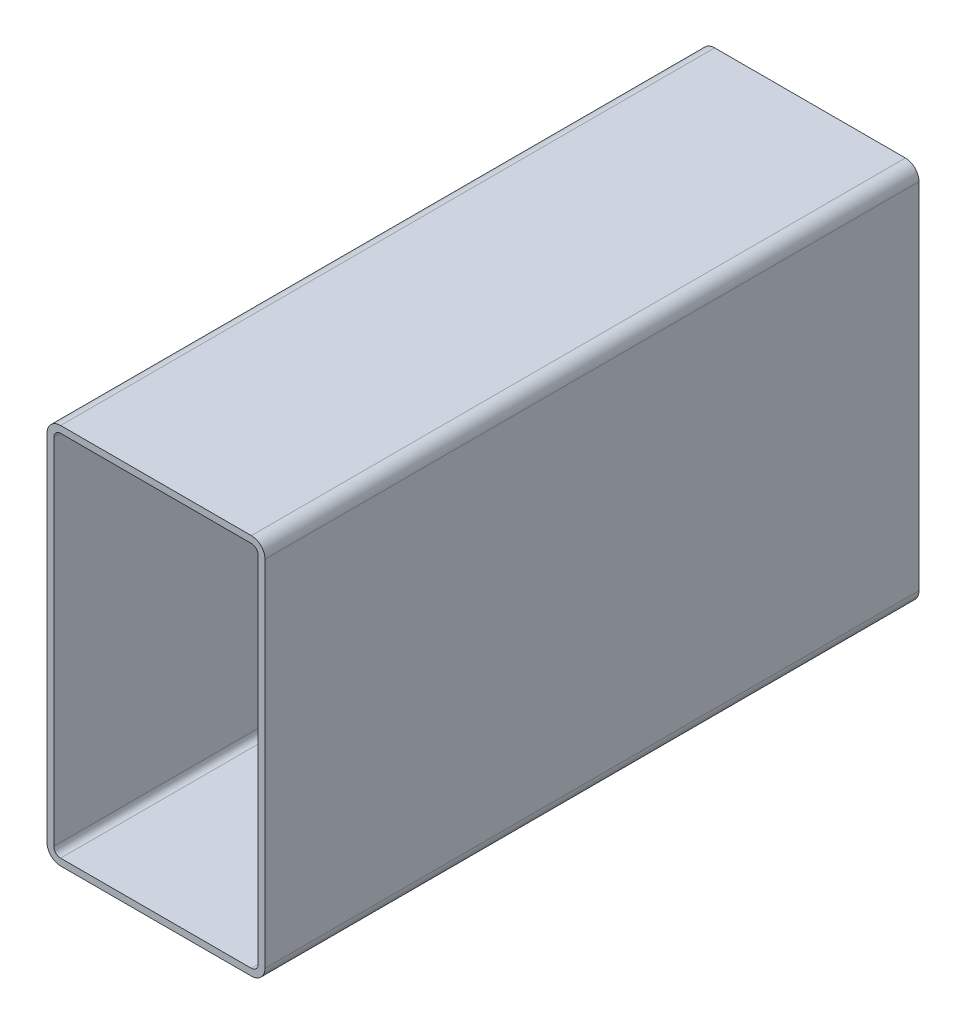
SolidWorks part; units mm, degrees
ref_plane "Front Plane" through (0, 0, 0) normal (0, 0, 1) x (1, 0, 0)
ref_plane "Top Plane" through (0, 0, 0) normal (0, 1, 0) x (1, 0, 0)
ref_plane "Right Plane" through (0, 0, 0) normal (1, 0, 0) x (0, 0, -1)
sketch "Sketch1" plane through (0, 0, 0) normal (0, 0, 1) x (1, 0, 0)
sketch_block_instance "HSS7x4x0.125-1"
sketch_block "HSS7x4x0.125"
extrude "Boss-Extrude1" add sketch "Sketch1" along normal blind 304.8
